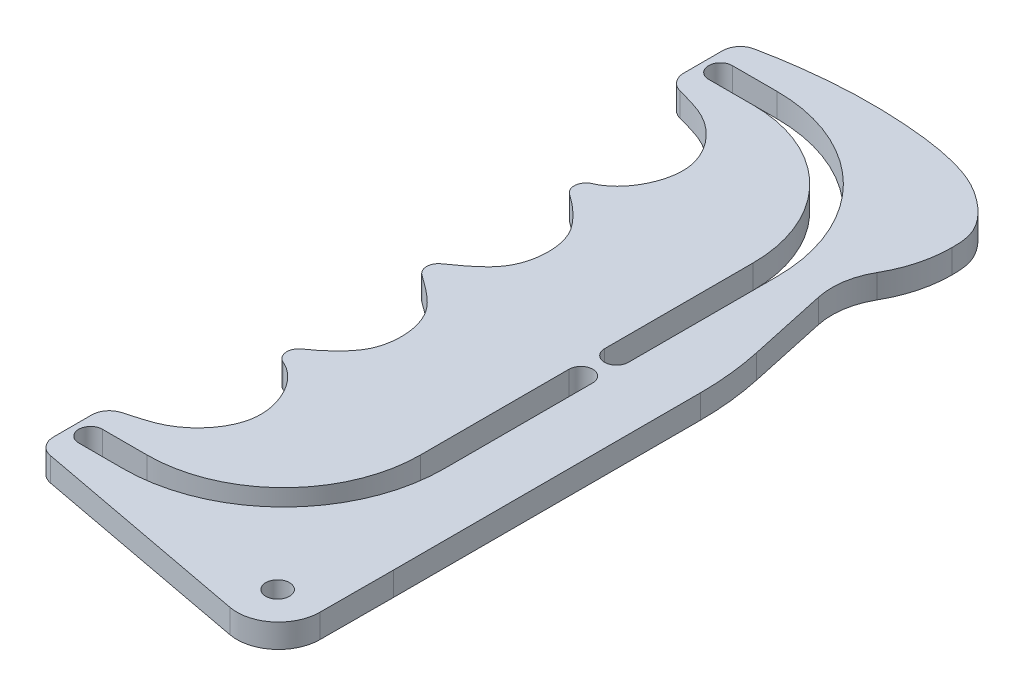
SolidWorks part; units mm, degrees
ref_plane "Alzado" through (0, 0, 0) normal (0, 0, 1) x (1, 0, 0)
ref_plane "Planta" through (0, 0, 0) normal (0, 1, 0) x (1, 0, 0)
ref_plane "Vista lateral" through (0, 0, 0) normal (1, 0, 0) x (0, 0, -1)
sketch "Croquis1"
extrude "Saliente-Extruir1" add sketch "Croquis1" along normal mid plane 4
sketch "Croquis4" plane through (0, 2, 0) normal (0, 1, 0) x (1, 0, 0)
  point P0 (0, 0)
sketch "Croquis5" plane through (-35.5, 0, 0) normal (-1, 0, 0) x (0, 0, 1)
  line L0 (-58.75, -2) -> (-47.25, -2) construction
  line L1 (0, 0) -> (0, 15.3094) construction
  point P0 (-53, 0)
  point P5 (-53, -2)
  point P7 (53, 0)
fillet "Redondeo1" radius 50 1 edges at (12.5, 0, -10)
fillet "Redondeo2" radius 3 4 edges at (-35.5, 0, 58.75) (-35.5, 0, 47.25) (-35.5, 0, -47.25) (-35.5, 0, -58.75)
equation "\"D7@Croquis1\"=\"D6@Croquis1\""
equation "\"D10@Croquis1\"=\"D9@Croquis1\""
